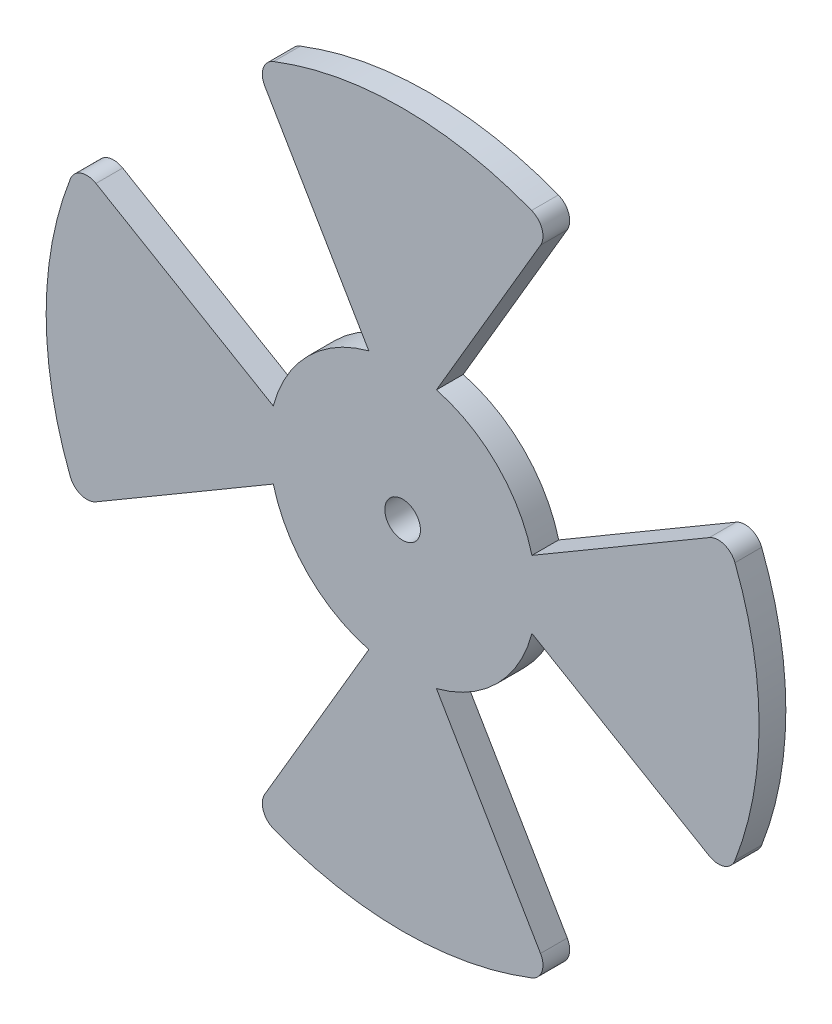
SolidWorks part; units mm, degrees
ref_plane "Front Plane" through (0, 0, 0) normal (0, 0, 1) x (1, 0, 0)
ref_plane "Top Plane" through (0, 0, 0) normal (0, 1, 0) x (1, 0, 0)
ref_plane "Right Plane" through (0, 0, 0) normal (1, 0, 0) x (0, 0, -1)
sketch "Sketch1" plane through (0, 0, 0) normal (0, 0, 1) x (1, 0, 0)
  line L0 (0, 0) -> (0, 31.811) construction
  line L1 (15.4722, 34.4139) -> (3.7933, 14.5124)
  line L2 (-15.4722, 34.4139) -> (-3.7933, 14.5124)
  line L3 (34.4139, -15.4722) -> (14.5124, -3.7933)
  line L4 (34.4139, 15.4722) -> (14.5124, 3.7933)
  line L5 (-15.4722, -34.4139) -> (-3.7933, -14.5124)
  line L6 (15.4722, -34.4139) -> (3.7933, -14.5124)
  line L7 (-34.4139, 15.4722) -> (-14.5124, 3.7933)
  line L8 (-34.4139, -15.4722) -> (-14.5124, -3.7933)
  arc A0 (14.4708, 37.2907) -> (-14.4708, 37.2907) centre (0, 0) ccw
  circle A1 centre (0, 0) radius 2
  circle A2 centre (0, 0) radius 12 construction
  arc A3 (37.2907, 14.4708) -> (34.4139, 15.4722) centre (35.4261, 13.7473) ccw
  circle A4 centre (0, 0) radius 38 construction
  arc A5 (-14.4708, 37.2907) -> (-15.4722, 34.4139) centre (-13.7473, 35.4261) ccw
  arc A6 (15.4722, 34.4139) -> (14.4708, 37.2907) centre (13.7473, 35.4261) ccw
  circle A7 centre (0, 12) radius 2 construction
  arc A8 (37.2907, -14.4708) -> (37.2907, 14.4708) centre (0, 0) ccw
  arc A9 (34.4139, -15.4722) -> (37.2907, -14.4708) centre (35.4261, -13.7473) ccw
  arc A10 (14.4708, -37.2907) -> (15.4722, -34.4139) centre (13.7473, -35.4261) ccw
  arc A11 (-14.4708, -37.2907) -> (14.4708, -37.2907) centre (0, 0) ccw
  arc A12 (-15.4722, -34.4139) -> (-14.4708, -37.2907) centre (-13.7473, -35.4261) ccw
  arc A13 (-37.2907, -14.4708) -> (-34.4139, -15.4722) centre (-35.4261, -13.7473) ccw
  arc A14 (-37.2907, 14.4708) -> (-37.2907, -14.4708) centre (0, 0) ccw
  arc A15 (-34.4139, 15.4722) -> (-37.2907, 14.4708) centre (-35.4261, 13.7473) ccw
  arc A16 (-3.7933, 14.5124) -> (-14.5124, 3.7933) centre (0, 0) ccw
  arc A17 (-14.5124, -3.7933) -> (-3.7933, -14.5124) centre (0, 0) ccw
  arc A18 (14.5124, 3.7933) -> (3.7933, 14.5124) centre (0, 0) ccw
  arc A19 (3.7933, -14.5124) -> (14.5124, -3.7933) centre (0, 0) ccw
  dimension "D1" = 40
  dimension "D2" = 4
  dimension "D3" = 24
  dimension "D4" = 4
  dimension "D5" = 30
extrude "Extrude1" add sketch "Sketch1" along normal blind 3
